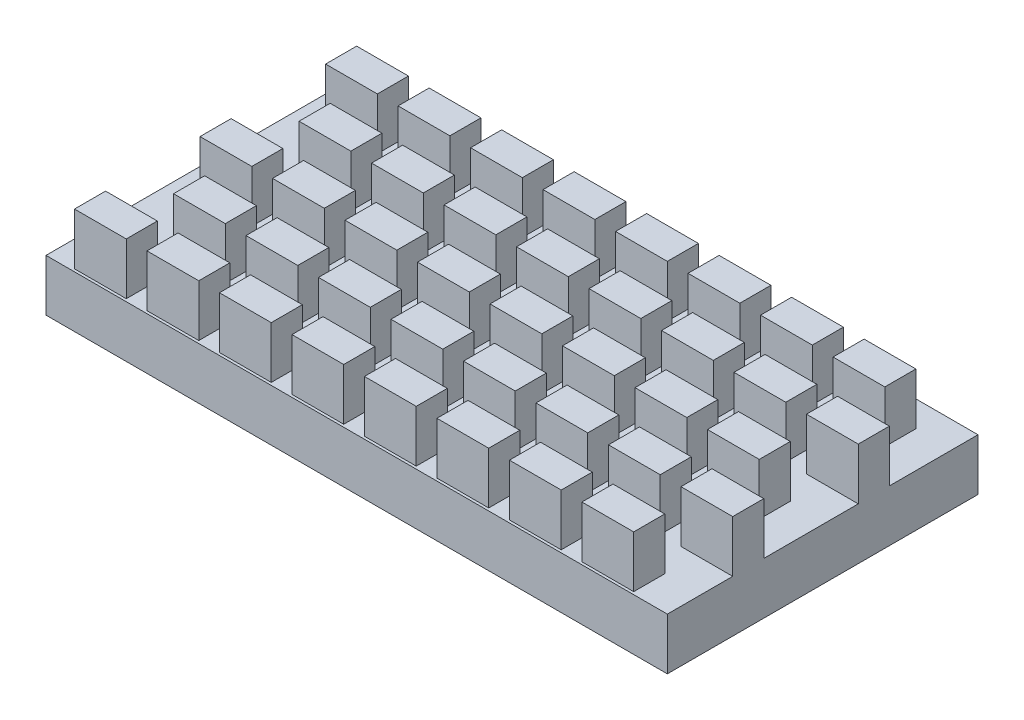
SolidWorks part; units mm, degrees
ref_plane "Front Plane" through (0, 0, 0) normal (0, 0, 1) x (1, 0, 0)
ref_plane "Top Plane" through (0, 0, 0) normal (0, 1, 0) x (1, 0, 0)
ref_plane "Right Plane" through (0, 0, 0) normal (1, 0, 0) x (0, 0, -1)
sketch "Sketch1" plane through (0, 0, 0) normal (0, 1, 0) x (1, 0, 0)
  line L1 (-76.2, 38.1) -> (76.2, 38.1)
  line L2 (-76.2, 38.1) -> (-76.2, -38.1)
  line L3 (-76.2, -38.1) -> (76.2, -38.1)
  line L4 (76.2, 38.1) -> (76.2, -38.1)
  dimension "D1" = 152.4
  dimension "D2" = 76.2
  dimension "D3" = 76.2
  dimension "D4" = 38.1
extrude "Extrude1" add sketch "Sketch1" along normal blind 12.7
sketch "Sketch2" plane through (0, 12.7, 0) normal (0, 1, 0) x (1, 0, 0)
  line L0 (-76.2, 38.1) -> (-76.2, -38.1) construction
  line L1 (-69.85, 31.75) -> (-57.15, 31.75)
  line L2 (-69.85, 31.75) -> (-69.85, 24.13)
  line L3 (-69.85, 24.13) -> (-57.15, 24.13)
  line L4 (-57.15, 31.75) -> (-57.15, 24.13)
  line L5 (76.2, 38.1) -> (-76.2, 38.1) construction
  dimension "D1" = 12.7
  dimension "D2" = 7.62
  dimension "D3" = 6.35
  dimension "D4" = 6.35
extrude "Extrude2" add sketch "Sketch2" along normal blind 12.7
other "Fill Pattern1" parameters "D1"=17.78, "D2"=60, "D3"=0
